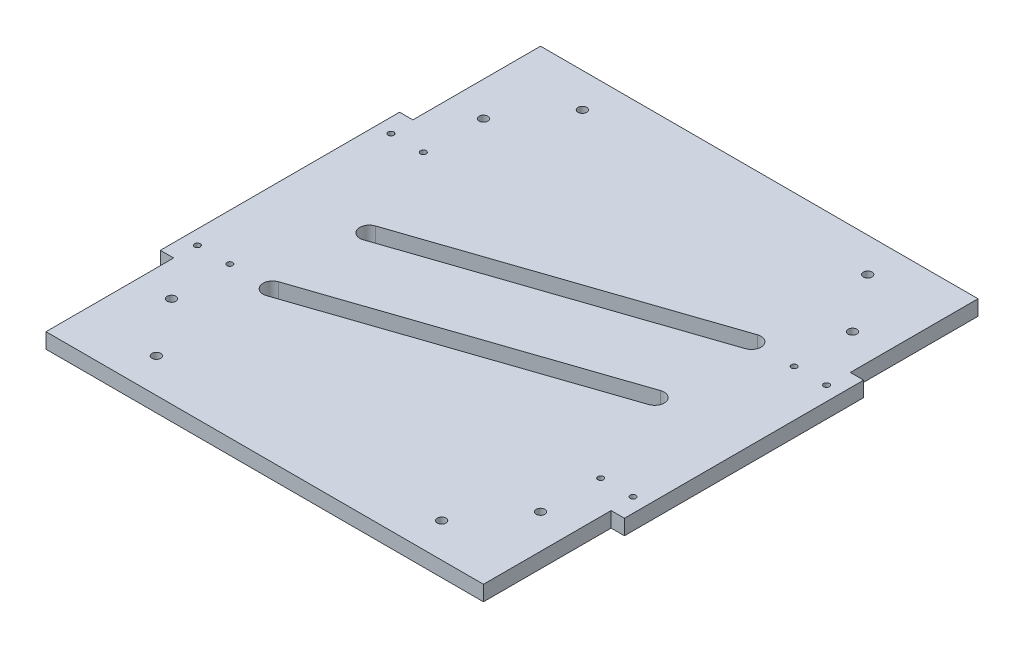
SolidWorks part; units mm, degrees
ref_plane "Front Plane" through (0, 0, 0) normal (0, 0, 1) x (1, 0, 0)
ref_plane "Top Plane" through (0, 0, 0) normal (0, 1, 0) x (1, 0, 0)
ref_plane "Right Plane" through (0, 0, 0) normal (1, 0, 0) x (0, 0, -1)
sketch "Sketch1" plane through (0, 0, 0) normal (0, 1, 0) x (1, 0, 0)
  line L0 (-194.7415, 0) -> (187.7686, 0) construction
  line L1 (0, -142.4765) -> (0, 136.302) construction
  line L2 (-115, 130) -> (115, 130)
  line L3 (115, 130) -> (115, 62.88)
  line L4 (115, 62.88) -> (122, 62.88)
  line L5 (122, 62.88) -> (122, -62.88)
  line L6 (122, -62.88) -> (115, -62.88)
  line L7 (115, -62.88) -> (115, -130)
  line L8 (115, -130) -> (-115, -130)
  line L9 (-115, -130) -> (-115, -62.88)
  line L10 (-115, -62.88) -> (-122, -62.88)
  line L11 (-122, -62.88) -> (-122, 62.88)
  line L12 (-122, 62.88) -> (-115, 62.88)
  line L13 (-115, 62.88) -> (-115, 130)
  line L14 (-115, -130) -> (-115, 130) construction
  line L15 (-124.3426, 112) -> (132.3511, 112) construction
  line L16 (-124.3426, -112) -> (132.3511, -112) construction
  line L17 (97, 152.5483) -> (97, -148.9457) construction
  line L18 (-97, 152.5483) -> (-97, -148.9457) construction
  line L19 (-75, 175.3843) -> (-75, -160.5453) construction
  line L20 (-115, -82) -> (-43.1208, -82) construction
  line L21 (75, 175.3843) -> (75, -160.5453) construction
  line L22 (115, -82) -> (43.1208, -82) construction
  line L23 (-115, 82) -> (-43.1208, 82) construction
  line L24 (115, 82) -> (43.1208, 82) construction
  line L25 (-136.0096, 50.875) -> (-43.1208, 50.875) construction
  line L26 (-114.5, 56.6634) -> (-114.5, -68.8291) construction
  line L27 (-97.5, 56.6634) -> (-97.5, -68.8291) construction
  line L28 (-136.0096, -50.875) -> (-43.1208, -50.875) construction
  line L29 (136.0096, 50.875) -> (43.1208, 50.875) construction
  line L30 (136.0096, -50.875) -> (43.1208, -50.875) construction
  line L31 (97.5, 56.6634) -> (97.5, -68.8291) construction
  line L32 (114.5, 56.6634) -> (114.5, -68.8291) construction
  line L33 (-75, 0) -> (75, 50.875) construction
  line L34 (-75, 0) -> (75, 50.875) construction
  line L35 (-76.606, 4.7351) -> (73.394, 55.6101)
  line L36 (-73.394, -4.7351) -> (76.606, 46.1399)
  line L37 (-75, -50.875) -> (75, 0) construction
  line L38 (-75, -50.875) -> (75, 0) construction
  line L39 (-76.606, -46.1399) -> (73.394, 4.7351)
  line L40 (-73.394, -55.6101) -> (76.606, -4.7351)
  circle A0 centre (-75, -112) radius 2.285
  circle A1 centre (-97, -82) radius 2.285
  circle A2 centre (97, -82) radius 2.285
  circle A3 centre (75, -112) radius 2.285
  circle A4 centre (75, 112) radius 2.285
  circle A5 centre (97, 82) radius 2.285
  circle A6 centre (-97, 82) radius 2.285
  circle A7 centre (-75, 112) radius 2.285
  circle A8 centre (-114.5, 50.875) radius 1.5
  circle A9 centre (-97.5, 50.875) radius 1.5
  circle A10 centre (-114.5, -50.875) radius 1.5
  circle A11 centre (-97.5, -50.875) radius 1.5
  circle A12 centre (97.5, -50.875) radius 1.5
  circle A13 centre (114.5, -50.875) radius 1.5
  circle A14 centre (97.5, 50.875) radius 1.5
  circle A15 centre (114.5, 50.875) radius 1.5
  arc A16 (-76.606, 4.7351) -> (-73.394, -4.7351) centre (-75, 0) ccw
  arc A17 (76.606, 46.1399) -> (73.394, 55.6101) centre (75, 50.875) ccw
  arc A18 (-76.606, -46.1399) -> (-73.394, -55.6101) centre (-75, -50.875) ccw
  arc A19 (76.606, -4.7351) -> (73.394, 4.7351) centre (75, 0) ccw
  point P19 (0, 130)
  point P20 (122, 0)
  point P21 (-122, 0)
  point P64 (-114.5, 50.875)
  point P65 (-97.5, 50.875)
  point P66 (-97.5, -50.875)
  point P67 (-114.5, -50.875)
  point P94 (0, 25.4375)
  point P101 (0, -25.4375)
  dimension "D11" = 4.57
  dimension "D12" = 4.57
  dimension "D16" = 3
  dimension "D17" = 3
  dimension "D18" = 3
  dimension "D19" = 3
  dimension "D20" = 5
  dimension "D21" = 5
  dimension "D1" = 230
  dimension "D2" = 260
  dimension "D3" = 125.76
  dimension "D4" = 67.12
  dimension "D5" = 7
  dimension "D6" = 7
  dimension "D7" = 18
  dimension "D8" = 18
  dimension "D9" = 40
  dimension "D10" = 48
  dimension "D13" = 50.875
  dimension "D14" = 7.5
  dimension "D15" = 17
extrude "Boss-Extrude1" add sketch "Sketch1" along normal blind 8
